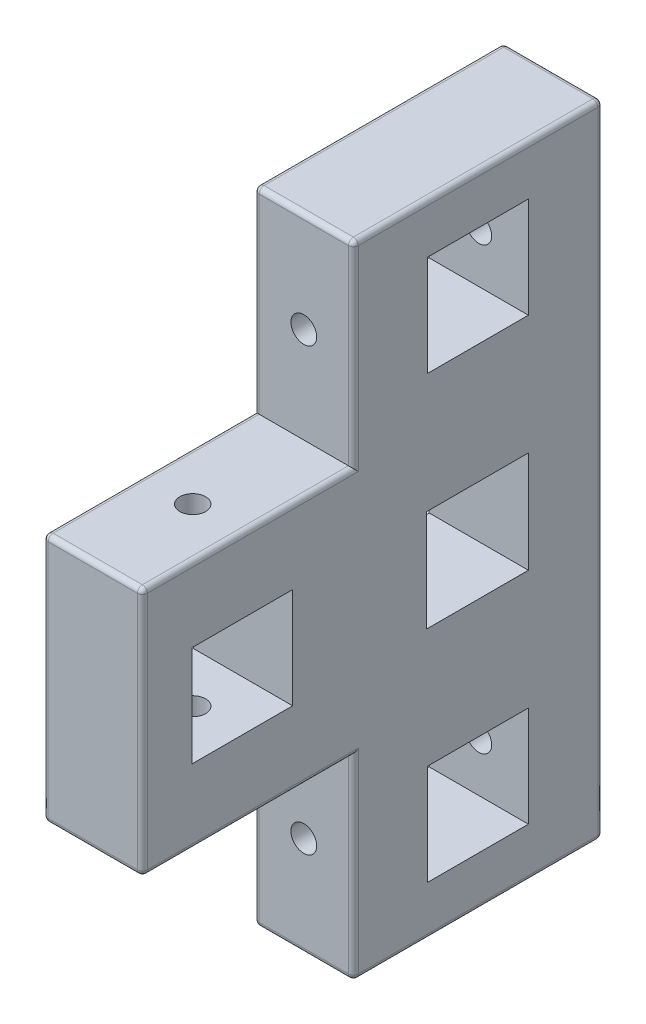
SolidWorks part; units mm, degrees
ref_plane "正面" through (0, 0, 0) normal (1, 0, 0) x (0, 1, 0)
ref_plane "平面" through (0, 0, 0) normal (0, 0, 1) x (0, 1, 0)
ref_plane "右側面" through (0, 0, 0) normal (0, 1, 0) x (-1, 0, 0)
sketch "ｽｹｯﾁ1" plane through (0, 0, 0) normal (1, 0, 0) x (0, 1, 0)
  line L0 (-56.5866, 2.4735) -> (-56.5866, -47.8265)
  line L1 (-56.5866, -47.8265) -> (72.6134, -47.8265)
  line L2 (72.6134, -47.8265) -> (72.6134, 2.4735)
  line L3 (72.6134, 2.4735) -> (33.1634, 2.4735)
  line L4 (33.1634, 2.4735) -> (33.1634, 45.0235)
  line L5 (33.1634, 45.0235) -> (-17.1366, 45.0235)
  line L6 (-17.1366, 45.0235) -> (-17.1366, 2.4735)
  line L7 (-17.1366, 2.4735) -> (-56.5866, 2.4735)
  dimension "D1" = 129.2
  dimension "D2" = 92.85
  dimension "D3" = 50.3
  dimension "D4" = 50.3
  dimension "D5" = 50.3
  dimension "D6" = 39.45
extrude "ﾎﾞｽ - 押し出し1" add sketch "ｽｹｯﾁ1" along normal mid plane 20
sketch "ｽｹｯﾁ2" plane through (10, 0, 0) normal (1, 0, 0) x (0, 1, 0)
  line L0 (-56.5866, 2.4735) -> (-56.5866, -47.8265) construction
  line L1 (-2.1366, 35.0235) -> (18.1634, 35.0235)
  line L2 (-2.1366, 35.0235) -> (-2.1366, 14.7235)
  line L3 (-2.1366, 14.7235) -> (18.1634, 14.7235)
  line L4 (18.1634, 35.0235) -> (18.1634, 14.7235)
  line L5 (-2.1366, 35.0235) -> (18.1634, 14.7235) construction
  line L6 (-2.1366, 14.7235) -> (18.1634, 35.0235) construction
  line L7 (-2.2366, -12.3265) -> (18.2634, -12.3265)
  line L8 (-2.2366, -12.3265) -> (-2.2366, -32.8265)
  line L9 (-2.2366, -32.8265) -> (18.2634, -32.8265)
  line L10 (18.2634, -12.3265) -> (18.2634, -32.8265)
  line L11 (-2.2366, -12.3265) -> (18.2634, -32.8265) construction
  line L12 (-2.2366, -32.8265) -> (18.2634, -12.3265) construction
  line L13 (-46.5866, -12.5265) -> (-26.2866, -12.5265)
  line L14 (-46.5866, -12.5265) -> (-46.5866, -32.8265)
  line L15 (-46.5866, -32.8265) -> (-26.2866, -32.8265)
  line L16 (-26.2866, -12.5265) -> (-26.2866, -32.8265)
  line L17 (-46.5866, -12.5265) -> (-26.2866, -32.8265) construction
  line L18 (-46.5866, -32.8265) -> (-26.2866, -12.5265) construction
  line L19 (42.3134, -12.5265) -> (62.6134, -12.5265)
  line L20 (42.3134, -12.5265) -> (42.3134, -32.8265)
  line L21 (42.3134, -32.8265) -> (62.6134, -32.8265)
  line L22 (62.6134, -12.5265) -> (62.6134, -32.8265)
  line L23 (42.3134, -12.5265) -> (62.6134, -32.8265) construction
  line L24 (42.3134, -32.8265) -> (62.6134, -12.5265) construction
  line L25 (72.6134, -47.8265) -> (72.6134, 2.4735) construction
  line L28 (33.1634, 45.0235) -> (-17.1366, 45.0235) construction
  line L30 (-56.5866, -47.8265) -> (72.6134, -47.8265) construction
  line L31 (33.1634, 2.4735) -> (33.1634, 45.0235) construction
  point P0 (8.0134, 24.8735)
  point P5 (8.0134, -22.5765)
  point P10 (-36.4366, -22.6765)
  point P15 (52.4634, -22.6765)
  dimension "D1" = 10
  dimension "D2" = 10
  dimension "D3" = 25.15
  dimension "D4" = 15
  dimension "D5" = 10
  dimension "D6" = 15
  dimension "D7" = 20.3
  dimension "D8" = 20.3
  dimension "D9" = 15
  dimension "D10" = 20.5
  dimension "D11" = 20.5
  dimension "D12" = 64.6
  dimension "D13" = 20.3
  dimension "D14" = 20.3
  dimension "D15" = 20.3
  dimension "D16" = 20.3
extrude "ｶｯﾄ - 押し出し1" cut sketch "ｽｹｯﾁ2" against normal through all
sketch "ｽｹｯﾁ3" plane through (0, 0, -47.8265) normal (0, 0, -1) x (1, 0, 0)
  line L0 (10, -72.6134) -> (-10, -72.6134) construction
  line L1 (10, 56.5866) -> (-10, 56.5866) construction
  circle A0 centre (0, 36.4366) radius 2.6
  circle A1 centre (0, -52.4634) radius 2.6
  dimension "D1" = 5.2
  dimension "D2" = 5.2
  dimension "D3" = 20.15
  dimension "D4" = 20.15
extrude "ｶｯﾄ - 押し出し2" cut sketch "ｽｹｯﾁ3" against normal through all
sketch "ｽｹｯﾁ4" plane through (0, -17.1366, 0) normal (0, -1, 0) x (1, 0, 0)
  line L0 (10, 45.0235) -> (-10, 45.0235) construction
  circle A0 centre (0, 24.8735) radius 2.6
  dimension "D1" = 5.2
  dimension "D2" = 20.15
extrude "ｶｯﾄ - 押し出し3" cut sketch "ｽｹｯﾁ4" against normal through all
fillet "ﾌｨﾚｯﾄ2" radius 1 22 edges at (-10, 8.0134, -47.8265) (0, -56.5866, -47.8265) (-10, -56.5866, -22.6765) (0, -56.5866, 2.4735) (-10, -36.8616, 2.4735) (-10, -17.1366, 23.7485) (0, -17.1366, 45.0235) (-10, 8.0134, 45.0235) (0, 33.1634, 45.0235) (-10, 33.1634, 23.7485) (-10, 52.8884, 2.4735) (-10, 72.6134, -22.6765) (0, 72.6134, 2.4735) (0, 72.6134, -47.8265) (10, 72.6134, -22.6765) (10, 8.0134, -47.8265) (10, -56.5866, -22.6765) (10, -36.8616, 2.4735) (10, -17.1366, 23.7485) (10, 8.0134, 45.0235) (10, 52.8884, 2.4735) (10, 33.1634, 23.7485)
